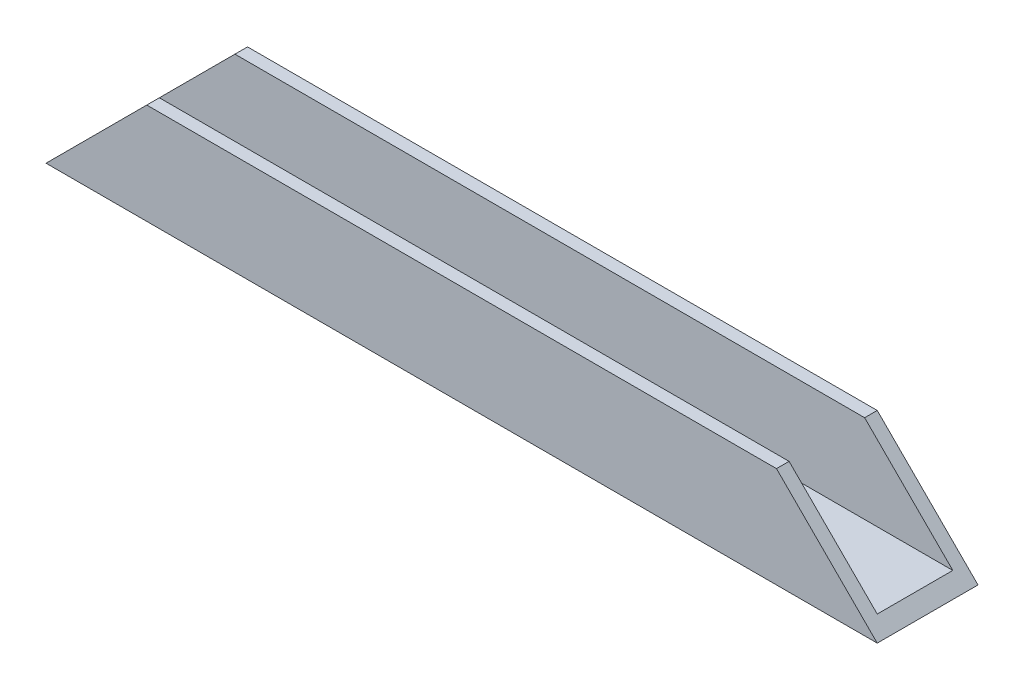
SolidWorks part; units mm, degrees
ref_plane "Front Plane" through (0, 0, 0) normal (0, 0, 1) x (1, 0, 0)
ref_plane "Top Plane" through (0, 0, 0) normal (0, 1, 0) x (1, 0, 0)
ref_plane "Right Plane" through (0, 0, 0) normal (1, 0, 0) x (0, 0, -1)
sketch "Sketch1" plane through (0, 0, 0) normal (1, 0, 0) x (0, 0, -1)
  line L0 (-9.525, 0) -> (9.525, 0)
  line L1 (9.525, 0) -> (9.525, 22.225)
  line L2 (9.525, 22.225) -> (12.7, 22.225)
  line L3 (12.7, 22.225) -> (12.7, -3.175)
  line L4 (12.7, -3.175) -> (-12.7, -3.175)
  line L5 (-12.7, -3.175) -> (-12.7, 22.225)
  line L6 (-12.7, 22.225) -> (-9.525, 22.225)
  line L7 (-9.525, 22.225) -> (-9.525, 0)
  point P3 (0, -3.175)
  point P10 (0, 0)
  dimension "D1" = 25.4
  dimension "D2" = 25.4
  dimension "D3" = 3.175
  dimension "D4" = 3.175
extrude "Boss-Extrude1" add sketch "Sketch1" along normal mid plane 209.55
sketch "Sketch2" plane through (0, 0, 12.7) normal (0, 0, 1) x (1, 0, 0)
  line L0 (-104.775, -3.175) -> (-79.375, 22.225)
  line L1 (104.775, 22.225) -> (-104.775, 22.225) construction
  line L2 (-79.375, 22.225) -> (79.375, 22.225)
  line L3 (79.375, 22.225) -> (104.775, -3.175)
  line L4 (104.775, -3.175) -> (-104.775, -3.175)
  dimension "D1" = 45
  dimension "D2" = 45
extrude "Cut-Extrude1" cut sketch "Sketch2" against normal through all flip side to cut
